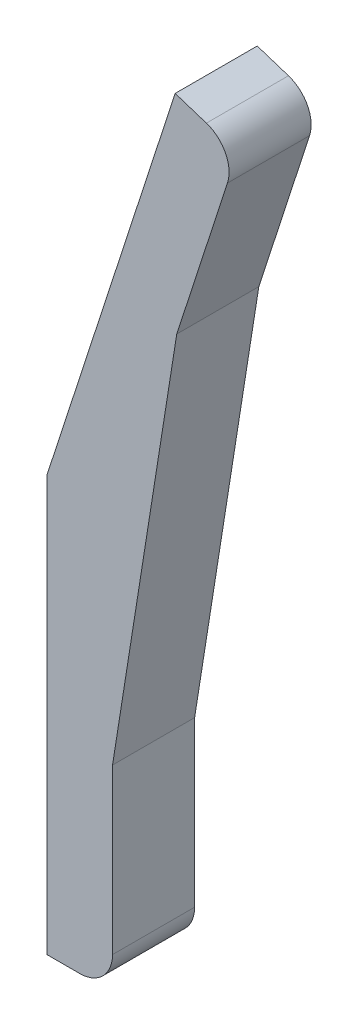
SolidWorks part; units mm, degrees
ref_plane "Front Plane" through (0, 0, 0) normal (0, 0, 1) x (1, 0, 0)
ref_plane "Top Plane" through (0, 0, 0) normal (0, 1, 0) x (1, 0, 0)
ref_plane "Right Plane" through (0, 0, 0) normal (1, 0, 0) x (0, 0, -1)
sketch "Sketch1" plane through (0, 0, 0) normal (0, 0, 1) x (1, 0, 0)
  line L0 (0, 0) -> (0, -32.1175)
  line L2 (0, -32.1175) -> (5.08, -32.1175)
  line L3 (5.08, -32.1175) -> (5.08, -16.8775)
  line L4 (5.08, -16.8775) -> (10.0468, 14.4816)
  line L5 (0, 0) -> (21.0396, -3.3323) construction
  line L7 (9.9248, 30.5455) -> (14.7562, 28.9757)
  line L8 (14.7562, 28.9757) -> (10.0468, 14.4816)
  line L9 (9.9248, 30.5455) -> (0, 0)
  point P12 (7.5634, -1.1979)
  dimension "D1" = 81
  dimension "D2" = 5.08
  dimension "D3" = 31.75
  dimension "D4" = 15.24
extrude "Boss-Extrude1" add sketch "Sketch1" against normal blind 6.35
fillet "Fillet1" radius 2.54 2 edges at (14.7562, 28.9757, -3.175) (5.08, -32.1175, -3.175)
